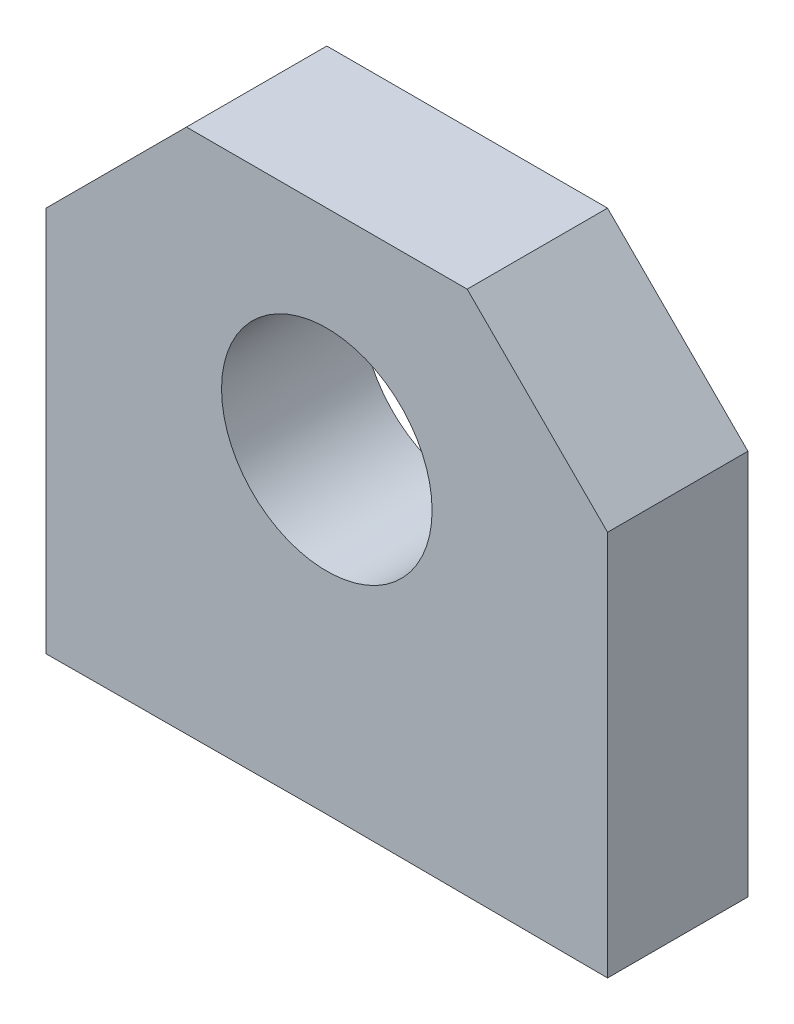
SolidWorks part; units mm, degrees
ref_plane "前视基准面" through (0, 0, 0) normal (0, 0, 1) x (1, 0, 0)
ref_plane "上视基准面" through (0, 0, 0) normal (0, 1, 0) x (1, 0, 0)
ref_plane "右视基准面" through (0, 0, 0) normal (1, 0, 0) x (0, 0, -1)
sketch "草图2" plane through (0, 0, 0) normal (0, 0, 1) x (1, 0, 0)
  line L0 (0, -1.9012) -> (0, 46.989) construction
  line L1 (0, 8.0772) -> (-16, 8)
  line L2 (-20, 8) -> (20, 8) construction
  line L3 (-16, 8) -> (-16, 30)
  line L4 (-16, 30) -> (-8, 38)
  line L5 (-8, 38) -> (8, 38)
  line L6 (-5.5793, 26.0772) -> (7.7251, 26.0772) construction
  line L7 (16, 30) -> (8, 38)
  line L8 (16, 8) -> (16, 30)
  line L9 (0, 8.0772) -> (16, 8)
  circle A0 centre (0, 26.0772) radius 6
  point P15 (0, 38)
  dimension "D1" = 12
  dimension "D2" = 8
  dimension "D3" = 22
  dimension "D4" = 30
  dimension "D5" = 18
  dimension "D6" = 16
extrude "凸台-拉伸2" add sketch "草图2" along normal blind 8 separate body
